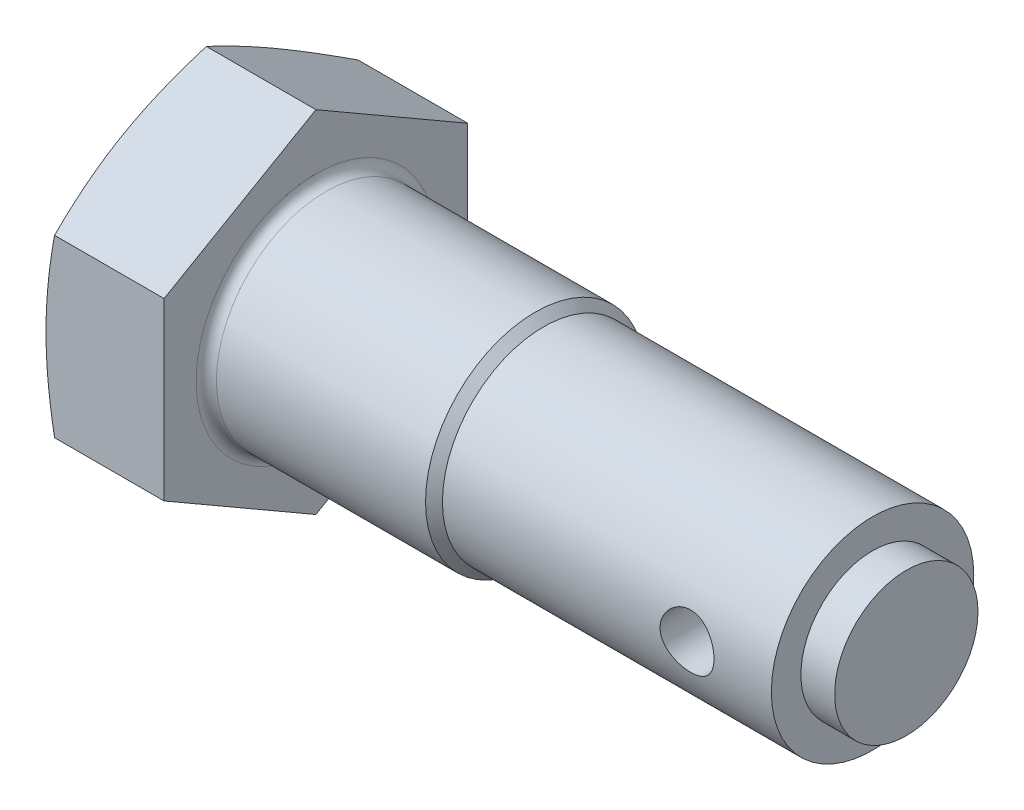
SolidWorks part; units mm, degrees
ref_plane "Front" through (0, 0, 0) normal (0, 0, 1) x (1, 0, 0)
ref_plane "Top" through (0, 0, 0) normal (0, 1, 0) x (1, 0, 0)
ref_plane "Right" through (0, 0, 0) normal (1, 0, 0) x (0, 0, -1)
sketch "Sketch1" plane through (0, 0, 0) normal (1, 0, 0) x (0, 0, -1)
  line L1 (0, -10.3923) -> (9, -5.1962)
  line L2 (9, -5.1962) -> (9, 5.1962)
  line L3 (9, 5.1962) -> (0, 10.3923)
  line L4 (0, 10.3923) -> (-9, 5.1962)
  line L5 (-9, 5.1962) -> (-9, -5.1962)
  line L6 (-9, -5.1962) -> (0, -10.3923)
  circle A0 centre (0, 0) radius 9 construction
  dimension "s" = 18
extrude "BaseHead" add sketch "Sketch1" along normal blind 7
sketch "Sketch2" plane through (7, 0, 0) normal (1, 0, 0) x (0, 0, -1)
  circle A0 centre (0, 0) radius 6.5
  dimension "ds" = 13
extrude "Basebody1" add sketch "Sketch2" along normal blind 13
sketch "Sketch4" plane through (20, 0, 0) normal (1, 0, 0) x (0, 0, -1)
  circle A0 centre (0, 0) radius 6
  dimension "d" = 12
extrude "Basebody2" add sketch "Sketch4" along normal offset from surface (22 mm away) 35
sketch "Sketch5" plane through (42, 0, 0) normal (1, 0, 0) x (0, 0, -1)
  circle A0 centre (0, 0) radius 4.25
  dimension "dp" = 8.5
extrude "Cut-Extrude1" cut sketch "Sketch5" against normal blind 2 flip side to cut
sketch "Sketch6" plane through (0, 0, 0) normal (0, 0, 1) x (1, 0, 0)
  line L0 (0, 10.3923) -> (0.5068, 10.3923)
  line L1 (0.5068, 10.3923) -> (0, 9)
  line L3 (0, 9) -> (0, 10.3923)
  line L4 (-1.5773, 0) -> (3.1205, 0) construction
  line L6 (7, 10.3923) -> (0, 10.3923) construction
  dimension "D1" = 20
  dimension "D2" = 18
revolve "HeadChamfer" cut sketch "Sketch6" angle 360 about L4
fillet "HeadFillet" radius 0.6 1 edges at (7, 0, -6.5)
chamfer "Chamfer1" distance 0.5 angle 45 1 edges at (20, 0, -6)
sketch "Sketch7" plane through (0, 0, 0) normal (0, 0, 1) x (1, 0, 0)
  line L1 (7, 10.3923) -> (7, 5.1962) construction
  line L4 (40, 0) -> (20.5, 0) construction
  circle A0 centre (35, 0) radius 1.6
  dimension "d1" = 3.2
  dimension "lh" = 28
extrude "Hole" cut sketch "Sketch7" against normal through all and the other way through all
equation "\"D1@Chamfer1\" =  ( \"ds@Sketch2\" - \"d@Sketch4\" )  / 2"
equation "\"D2@Sketch6\" = \"s@Sketch1\""
